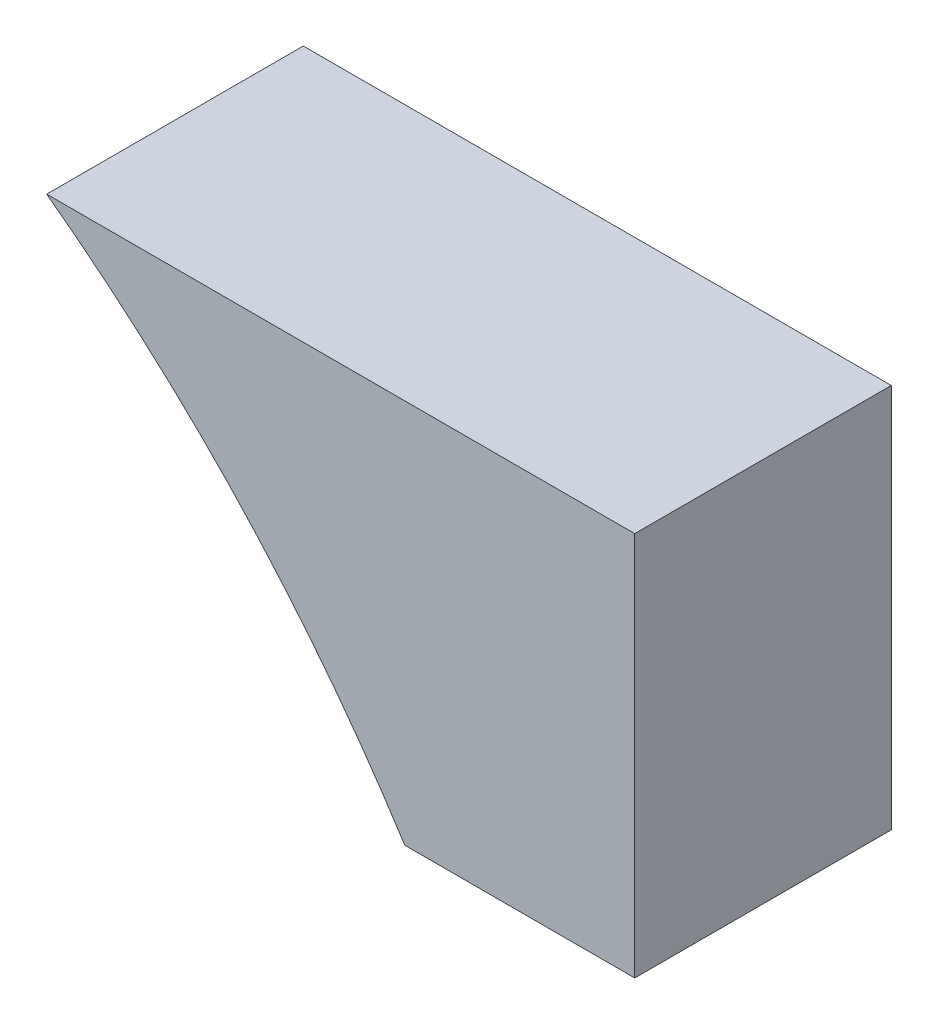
SolidWorks part; units mm, degrees
ref_plane "Plan de face" through (0, 0, 0) normal (0, 0, 1) x (1, 0, 0)
ref_plane "Plan de dessus" through (0, 0, 0) normal (0, 1, 0) x (1, 0, 0)
ref_plane "Plan de droite" through (0, 0, 0) normal (1, 0, 0) x (0, 0, -1)
sketch "Esquisse1" plane through (0, 0, 0) normal (0, 0, 1) x (1, 0, 0)
  line L0 (0, 0) -> (470.6608, 0) construction
  line L1 (0, -55.3377) -> (0, 353.7921) construction
  line L2 (0, 0) -> (442.2765, 160.9755) construction
  line L3 (0, 0) -> (360.5471, 302.5349) construction
  line L4 (0, 0) -> (235.3304, 407.6042) construction
  line L5 (0, 0) -> (81.7294, 463.5104) construction
  line L6 (0, 0) -> (-81.7294, 463.5104) construction
  line L7 (0, 0) -> (-235.3304, 407.6042) construction
  line L8 (0, 0) -> (-360.5471, 302.5349) construction
  line L9 (0, 0) -> (-442.2765, 160.9755) construction
  line L10 (0, 0) -> (-470.6608, 0) construction
  line L11 (-390.3547, -30) -> (366.2536, -30) construction
  line L12 (-390.3547, 30) -> (366.2536, 30) construction
  line L13 (-390.3547, 60) -> (366.2536, 60) construction
  line L14 (22.5, -55.3377) -> (22.5, 160.9755) construction
  line L15 (366.2536, 90) -> (-390.3547, 90) construction
  line L16 (45, -55.3377) -> (45, 160.9755) construction
  line L17 (-390.3547, 120) -> (366.2536, 120) construction
  line L18 (-90, -59.8279) -> (-90, 0) construction
  line L19 (366.2536, 150) -> (-390.3547, 150) construction
  line L20 (67.5, -55.3377) -> (67.5, 160.9755) construction
  line L21 (90, -55.3377) -> (90, 160.9755) construction
  line L22 (112.5, -55.3377) -> (112.5, 160.9755) construction
  line L23 (135, -55.3377) -> (135, 160.9755) construction
  line L24 (157.5, -55.3377) -> (157.5, 160.9755) construction
  line L25 (180, -55.3377) -> (180, 160.9755) construction
  line L26 (202.5, -55.3377) -> (202.5, 160.9755) construction
  line L27 (225, -55.3377) -> (225, 160.9755) construction
  line L28 (66.6633, 90) -> (112.5, 90)
  line L29 (112.5, 90) -> (112.5, 60)
  line L30 (112.5, 60) -> (94.5727, 60)
  arc A0 (90, 0) -> (-90, 0) centre (0, 0) ccw construction
  arc A1 (112, 0) -> (-112, 0) centre (0, 0) ccw construction
  arc A2 (94.5727, 60) -> (66.6633, 90) centre (0, 0) ccw
extrude "Extrusion1" add sketch "Esquisse1" along normal blind 20
